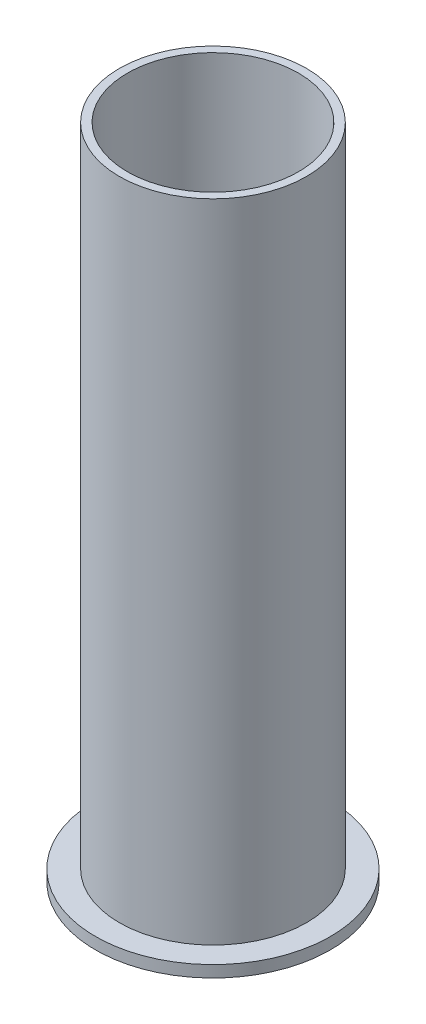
SolidWorks part; units mm, degrees
ref_plane "Front Plane" through (0, 0, 0) normal (0, 0, 1) x (1, 0, 0)
ref_plane "Top Plane" through (0, 0, 0) normal (0, 1, 0) x (1, 0, 0)
ref_plane "Right Plane" through (0, 0, 0) normal (1, 0, 0) x (0, 0, -1)
sketch "Sketch1" plane through (0, 0, 0) normal (0, 1, 0) x (1, 0, 0)
  circle A0 centre (0, 0) radius 5.7785
  circle A1 centre (0, 0) radius 6.3246
  dimension "D1" = 11.557
  dimension "D2" = 12.6492
extrude "Boss-Extrude1" add sketch "Sketch1" along normal blind 44.45
sketch "Sketch2" plane through (0, 0, 0) normal (0, -1, 0) x (1, 0, 0)
  circle A0 centre (0, 0) radius 5.7785 construction
  circle A1 centre (0, 0) radius 5.7785
  circle A2 centre (0, 0) radius 7.9375
  dimension "D1" = 15.875
extrude "Boss-Extrude2" add sketch "Sketch2" against normal blind 0.7874
